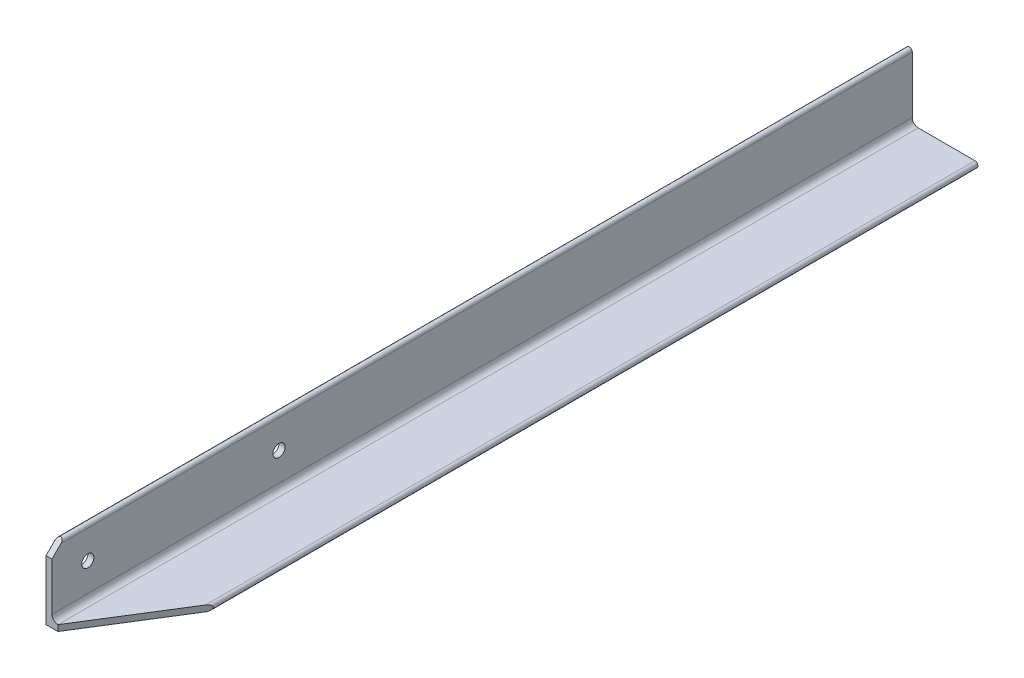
SolidWorks part; units mm, degrees
ref_plane "Front" through (0, 0, 0) normal (0, 0, 1) x (1, 0, 0)
ref_plane "Top" through (0, 0, 0) normal (0, 1, 0) x (1, 0, 0)
ref_plane "Right" through (0, 0, 0) normal (1, 0, 0) x (0, 0, -1)
sketch "Sketch1" plane through (0, 0, 0) normal (0, 0, 1) x (1, 0, 0)
  line L0 (0, 0) -> (0, 36.5125)
  line L1 (0, 0) -> (36.5125, 0)
  line L2 (6.35, 3.175) -> (36.5125, 3.175)
  line L3 (3.175, 6.35) -> (3.175, 36.5125)
  line L4 (3.175, 3.175) -> (3.175, 38.1) construction
  line L5 (3.175, 3.175) -> (38.1, 3.175) construction
  line L6 (0, 38.1) -> (3.175, 38.1) construction
  line L7 (38.1, 3.175) -> (38.1, 0) construction
  line L9 (0, 0) -> (38.1, 0) construction
  line L10 (0, 0) -> (0, 38.1) construction
  arc A0 (3.175, 6.35) -> (6.35, 3.175) centre (6.35, 6.35) ccw
  arc A1 (3.175, 36.5125) -> (0, 36.5125) centre (1.5875, 36.5125) ccw
  arc A2 (36.5125, 0) -> (36.5125, 3.175) centre (36.5125, 1.5875) ccw
  dimension "D4" = 3.175
  dimension "D1" = 38.1
  dimension "D2" = 38.1
  dimension "D3" = 3.175
extrude "Boss-Extrude1" add sketch "Sketch1" along normal mid plane 457.2
sketch "Sketch2" plane through (3.175, 0, 0) normal (1, 0, 0) x (0, 0, -1)
  line L0 (-228.6, 31.75) -> (-222.25, 38.1)
  line L1 (-228.6, 6.35) -> (-228.6, 36.5125) construction
  line L2 (228.6, 38.1) -> (-228.6, 38.1) construction
  line L3 (-222.25, 38.1) -> (-228.6, 38.1)
  line L4 (-228.6, 38.1) -> (-228.6, 36.5125) construction
  line L5 (-228.6, 38.1) -> (-228.6, 31.75)
  circle A0 centre (-209.55, 21.4313) radius 3.2385
  circle A1 centre (-107.95, 21.4313) radius 3.2385
  point P11 (-228.6, 21.4313)
  dimension "D4" = 6.477
  dimension "D1" = 6.35
  dimension "D2" = 6.35
  dimension "D3" = 19.05
  dimension "D5" = 2
extrude "Cut-Extrude1" cut sketch "Sketch2" against normal through all
sketch "Sketch3" plane through (0, 0, 0) normal (0, -1, 0) x (-1, 0, 0)
  line L0 (-38.1, -228.6) -> (-38.1, -177.8)
  line L1 (-38.1, 228.6) -> (-38.1, -228.6) construction
  line L2 (-38.1, -177.8) -> (-6.35, -228.6)
  line L3 (0, -228.6) -> (-36.5125, -228.6) construction
  line L4 (-6.35, -228.6) -> (-38.1, -228.6)
  dimension "D1" = 31.75
  dimension "D2" = 50.8
extrude "Cut-Extrude2" cut sketch "Sketch3" against normal through all
